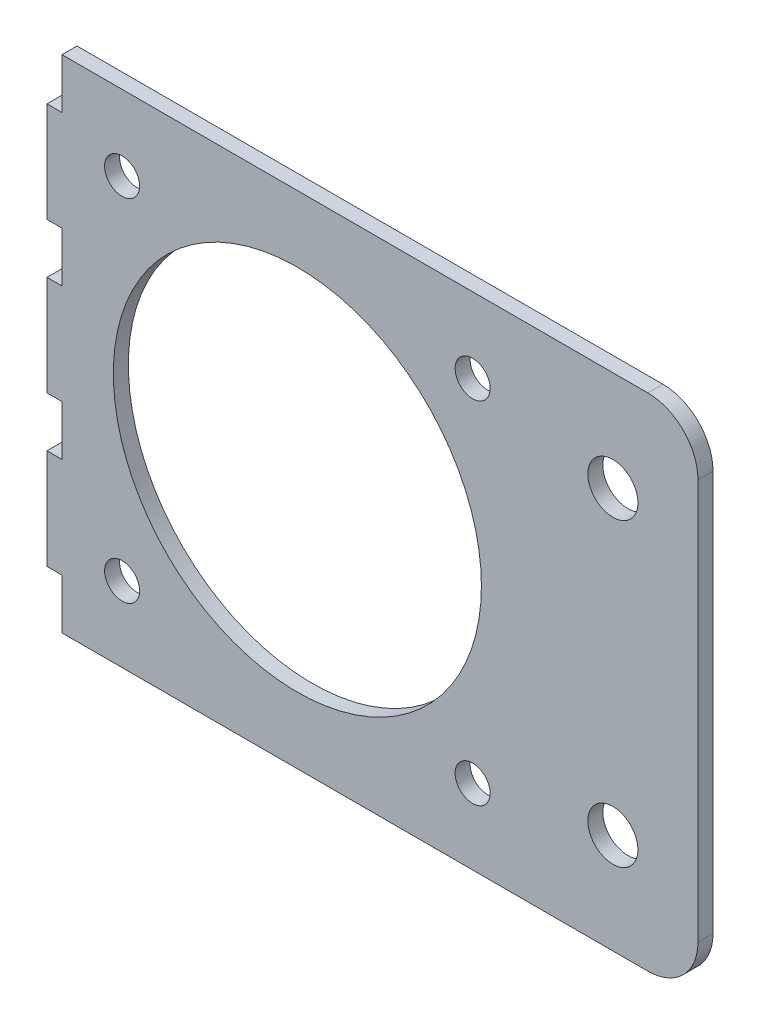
SolidWorks part; units mm, degrees
ref_plane "Plan de face" through (0, 0, 0) normal (0, 0, 1) x (1, 0, 0)
ref_plane "Plan de dessus" through (0, 0, 0) normal (0, 1, 0) x (1, 0, 0)
ref_plane "Plan de droite" through (0, 0, 0) normal (1, 0, 0) x (0, 0, -1)
sketch "Esquisse1" plane through (0, 0, 0) normal (0, 0, 1) x (1, 0, 0)
  line L1 (0, 0) -> (130, 0)
  line L2 (0, 0) -> (0, 100)
  line L3 (0, 100) -> (130, 100)
  line L4 (130, 0) -> (130, 100)
  dimension "D1" = 100
  dimension "D2" = 130
extrude "Boss.-Extru.1" add sketch "Esquisse1" along normal blind 3
sketch "Esquisse2" plane through (0, 0, 3) normal (0, 0, 1) x (1, 0, 0)
  line L0 (0, 100) -> (0, 0) construction
  line L1 (0, 100) -> (3, 100)
  line L2 (0, 100) -> (0, 90)
  line L3 (0, 90) -> (3, 90)
  line L4 (3, 100) -> (3, 90)
  line L5 (0, 70) -> (3, 70)
  line L6 (0, 70) -> (0, 60)
  line L7 (0, 60) -> (3, 60)
  line L8 (3, 70) -> (3, 60)
  line L10 (0, 40) -> (3, 40)
  line L11 (0, 40) -> (0, 30)
  line L12 (0, 30) -> (3, 30)
  line L13 (3, 40) -> (3, 30)
  line L14 (0, 0) -> (3, 0)
  line L15 (0, 0) -> (0, 10)
  line L16 (0, 10) -> (3, 10)
  line L17 (3, 0) -> (3, 10)
  dimension "D1" = 20
  dimension "D2" = 10
  dimension "D3" = 20
  dimension "D4" = 20
  dimension "D5" = 10
  dimension "D6" = 10
  dimension "D7" = 10
  dimension "D8" = 3
  dimension "D9" = 3
  dimension "D10" = 3
  dimension "D11" = 3
extrude "Enlèv. mat.-Extru.1" cut sketch "Esquisse2" against normal up to next
sketch "Esquisse3" plane through (0, 0, 3) normal (0, 0, 1) x (1, 0, 0)
  line L1 (130, 100) -> (3, 100) construction
  line L2 (3, 90) -> (3, 100) construction
  line L3 (3, 0) -> (3, 10) construction
  line L4 (3, 0) -> (130, 0) construction
  circle A0 centre (50, 50) radius 36.75
  circle A1 centre (15, 85) radius 3.5
  circle A2 centre (85, 85) radius 3.5
  circle A3 centre (15, 15) radius 3.5
  circle A4 centre (85, 15) radius 3.5
  circle A5 centre (113, 80) radius 5
  circle A6 centre (113, 20) radius 5
  dimension "D1" = 73.5
  dimension "D3" = 7
  dimension "D4" = 7
  dimension "D5" = 70
  dimension "D6" = 70
  dimension "D7" = 70
  dimension "D8" = 70
  dimension "D13" = 60
  dimension "D2" = 35
  dimension "D9" = 15
  dimension "D10" = 12
  dimension "D11" = 12
  dimension "D12" = 15
  dimension "D14" = 20
  dimension "D15" = 110
extrude "Enlèv. mat.-Extru.2" cut sketch "Esquisse3" against normal blind 3
fillet "Congé1" radius 10 2 edges at (130, 0, 1.5) (130, 100, 1.5)
